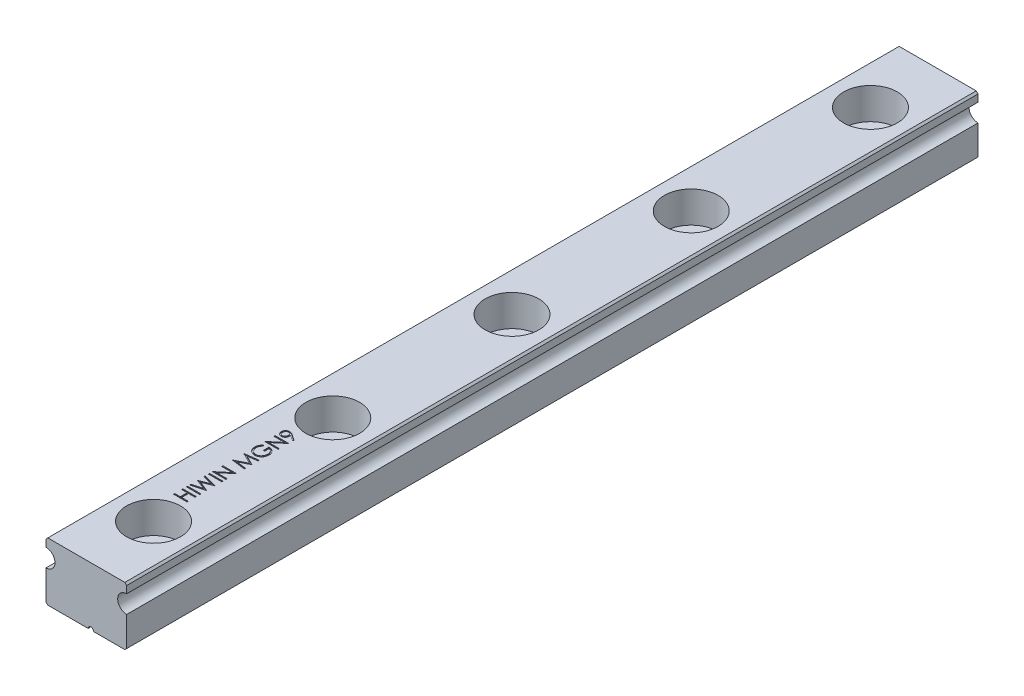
SolidWorks part; units mm, degrees
ref_plane "前视基准面" through (0, 0, 0) normal (0, 0, 1) x (1, 0, 0)
ref_plane "上视基准面" through (0, 0, 0) normal (0, 1, 0) x (1, 0, 0)
ref_plane "右视基准面" through (0, 0, 0) normal (1, 0, 0) x (0, 0, -1)
sketch "草图1" plane through (0, 0, 0) normal (0, 0, 1) x (1, 0, 0)
  line L2 (4.5, 5.5) -> (4.5, 6.3)
  line L3 (-4.3, 6.5) -> (-4.5, 6.3)
  line L4 (4.5, 0.2) -> (4.5, 3.5)
  line L5 (4.3, 6.5) -> (-4.3, 6.5)
  line L6 (4.5, 6.3) -> (4.3, 6.5)
  line L7 (-4.3, 0) -> (0.2, 0)
  line L8 (4.3, 0) -> (4.5, 0.2)
  line L9 (0.8, 0) -> (4.3, 0)
  line L10 (-4.5, 0.2) -> (-4.3, 0)
  line L11 (0, 6.5) -> (0, 0) construction
  line L12 (-4.5, 3.5) -> (-4.5, 0.2)
  line L13 (-4.5, 6.3) -> (-4.5, 5.5)
  arc A0 (-4.5, 3.5) -> (-4.5, 5.5) centre (-4.5, 4.5) ccw
  arc A1 (0.8, 0) -> (0.2, 0) centre (0.5, 0) ccw
  arc A2 (4.5, 5.5) -> (4.5, 3.5) centre (4.5, 4.5) ccw
extrude "凸台-拉伸1" add sketch "草图1" against normal blind 95
hole_wizard "M3 六角凹头螺钉的柱形沉头孔1" positions "草图3" profile "草图2" counterbore size "M3" standard "ISO"
sketch "草图3" plane through (0.7549, 6.5, 19.3435) normal (0, 1, 0) x (-1, 0, 0)
  point P0 (0.7549, -26.8435)
  dimension "D1" = 7.5
sketch "草图2" plane through (0, 6.5, -7.5) normal (1, 0, 0) x (0, 0, 1)
  line L0 (0, 0) -> (0, 6.5)
  line L1 (0, 6.5) -> (1.75, 6.5)
  line L3 (1.75, 6.5) -> (1.75, 3.5)
  line L4 (1.75, 3.5) -> (3, 3.5)
  line L5 (3, 3.5) -> (3, 0)
  line L7 (3, 0) -> (0, 0)
  line L11 (0, -6.35) -> (0, 107.95) construction
  dimension "通孔孔直径" = 3.5
  dimension "通孔孔深度" = 6.5
  dimension "柱形沉头孔直径" = 6
  dimension "柱形沉头孔深度" = 3.5
pattern_linear "阵列(线性)1" count 5 spacing 20 along (0, 0, -1) of "M3 六角凹头螺钉的柱形沉头孔1"
sketch "草图6" plane through (0, 6.5, 0) normal (0, 1, 0) x (1, 0, 0)
  line L0 (0, 7.5) -> (0, 27.5) construction
  text T0 "HIWIN MGN9" font "Century Gothic" height 1.5
extrude "切除-拉伸1" cut sketch "草图6" against normal blind 0.1
equation "\"D1@凸台-拉伸1\" = 2 * \"D1@草图3\" + \"D3@阵列(线性)1\" *  ( \"D1@阵列(线性)1\"  - 1) "
